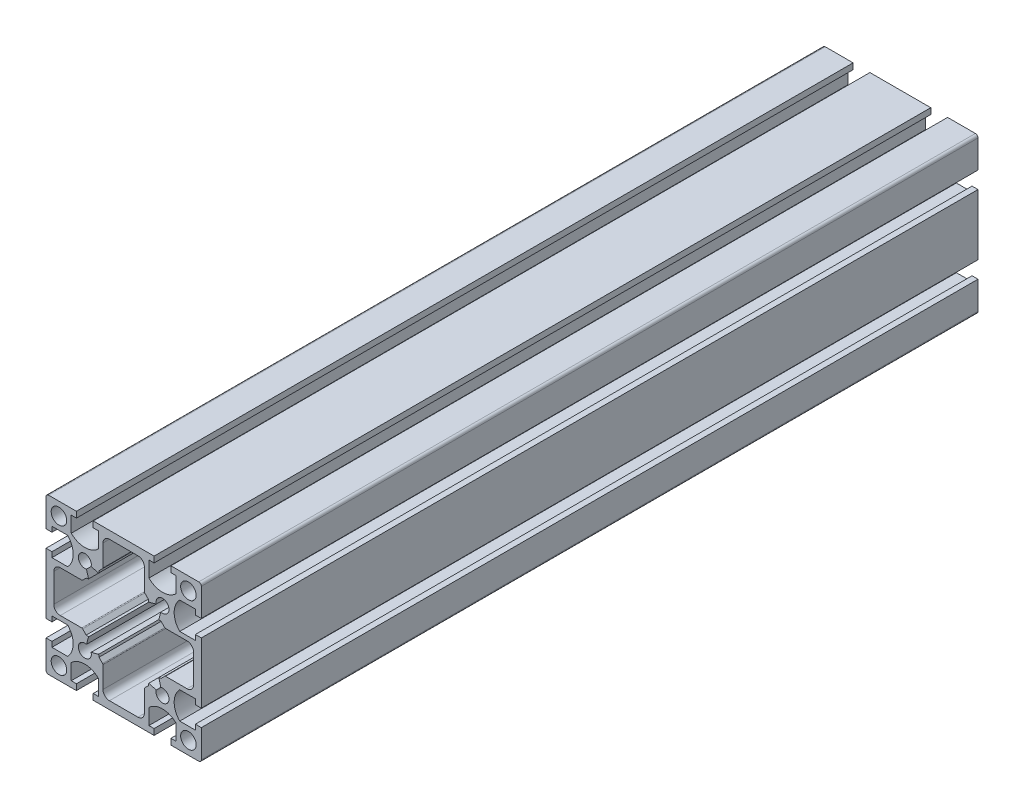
SolidWorks part; units mm, degrees
ref_plane "前视基准面" through (0, 0, 0) normal (0, 0, 1) x (1, 0, 0)
ref_plane "上视基准面" through (0, 0, 0) normal (0, 1, 0) x (1, 0, 0)
ref_plane "右视基准面" through (0, 0, 0) normal (1, 0, 0) x (0, 0, -1)
sketch "草图1"
sketch_block_instance "A$C7A4F1A00-1"
sketch_block "A$C7A4F1A00"
extrude "凸台-拉伸1" add sketch "草图1" along normal mid plane 300
